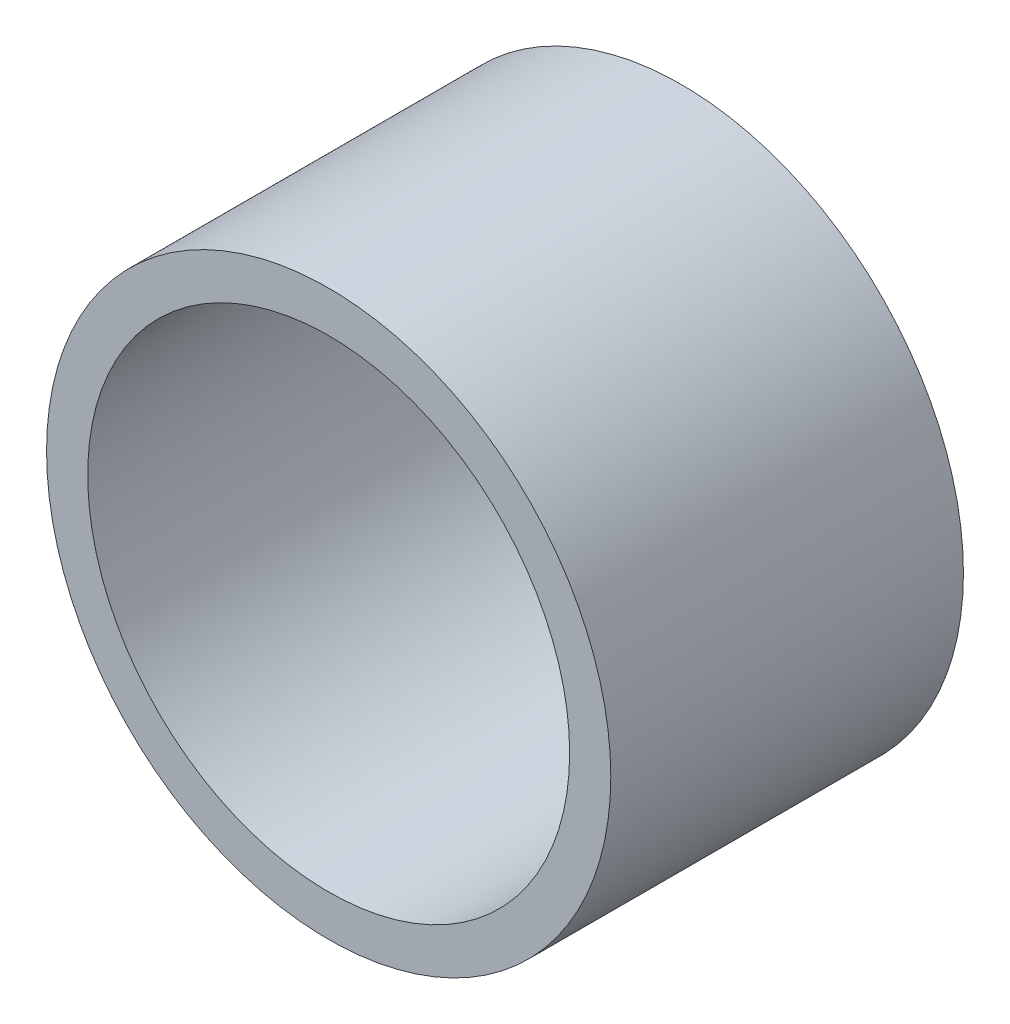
SolidWorks part; units mm, degrees
ref_plane "Alzado" through (0, 0, 0) normal (0, 0, 1) x (1, 0, 0)
ref_plane "Planta" through (0, 0, 0) normal (0, 1, 0) x (1, 0, 0)
ref_plane "Vista lateral" through (0, 0, 0) normal (1, 0, 0) x (0, 0, -1)
sketch "Sketch1" plane through (0, 0, 0) normal (0, 0, 1) x (1, 0, 0)
  circle A0 centre (0, 0) radius 10.25
  circle A1 centre (0, 0) radius 12
  dimension "D1" = 20.5
  dimension "D2" = 24
extrude "Boss-Extrude1" add sketch "Sketch1" along normal blind 15
